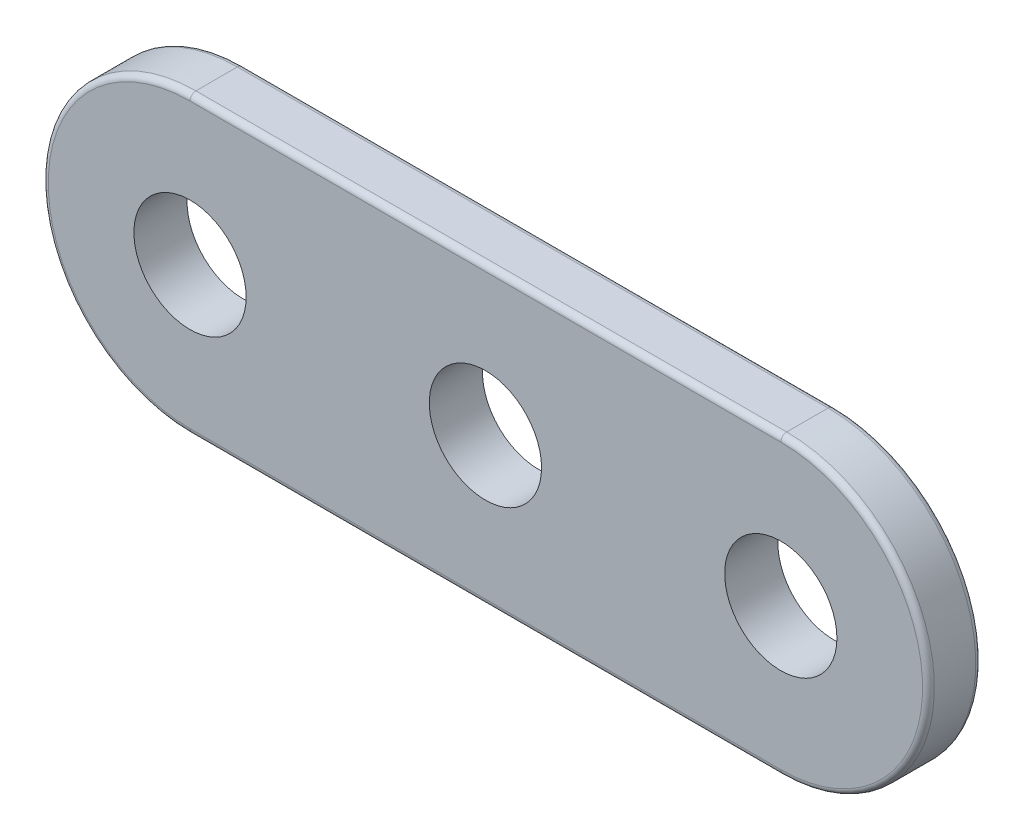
SolidWorks part; units mm, degrees
ref_plane "Front Plane" through (0, 0, 0) normal (0, 0, 1) x (1, 0, 0)
ref_plane "Top Plane" through (0, 0, 0) normal (0, 1, 0) x (1, 0, 0)
ref_plane "Right Plane" through (0, 0, 0) normal (1, 0, 0) x (0, 0, -1)
sketch "Sketch1" plane through (0, 0, 0) normal (0, 0, 1) x (1, 0, 0)
  line L0 (-12.7, 0) -> (12.7, 0) construction
  line L1 (-12.7, 6.35) -> (12.7, 6.35)
  line L2 (-12.7, -6.35) -> (12.7, -6.35)
  arc A0 (-12.7, 6.35) -> (-12.7, -6.35) centre (-12.7, 0) ccw
  arc A1 (12.7, -6.35) -> (12.7, 6.35) centre (12.7, 0) ccw
  point P2 (0, 0)
  dimension "D2" = 6.35
  dimension "D1" = 25.4
extrude "Boss-Extrude1" add sketch "Sketch1" along normal blind 2.286
sketch "Sketch2" plane through (0, 0, 2.286) normal (0, 0, 1) x (1, 0, 0)
  circle A0 centre (-12.7, 0) radius 2.413
  dimension "D1" = 4.826
extrude "Cut-Extrude1" cut sketch "Sketch2" against normal through all
pattern_linear "LPattern1" count 3 spacing 12.7 along (1, 0, 0) of "Cut-Extrude1"
fillet "Fillet1" radius 0.254 8 edges at (19.05, 0, 0) (0, -6.35, 0) (-19.05, 0, 0) (19.05, 0, 2.286) (0, -6.35, 2.286) (-19.05, 0, 2.286) (0, 6.35, 0) (0, 6.35, 2.286)
